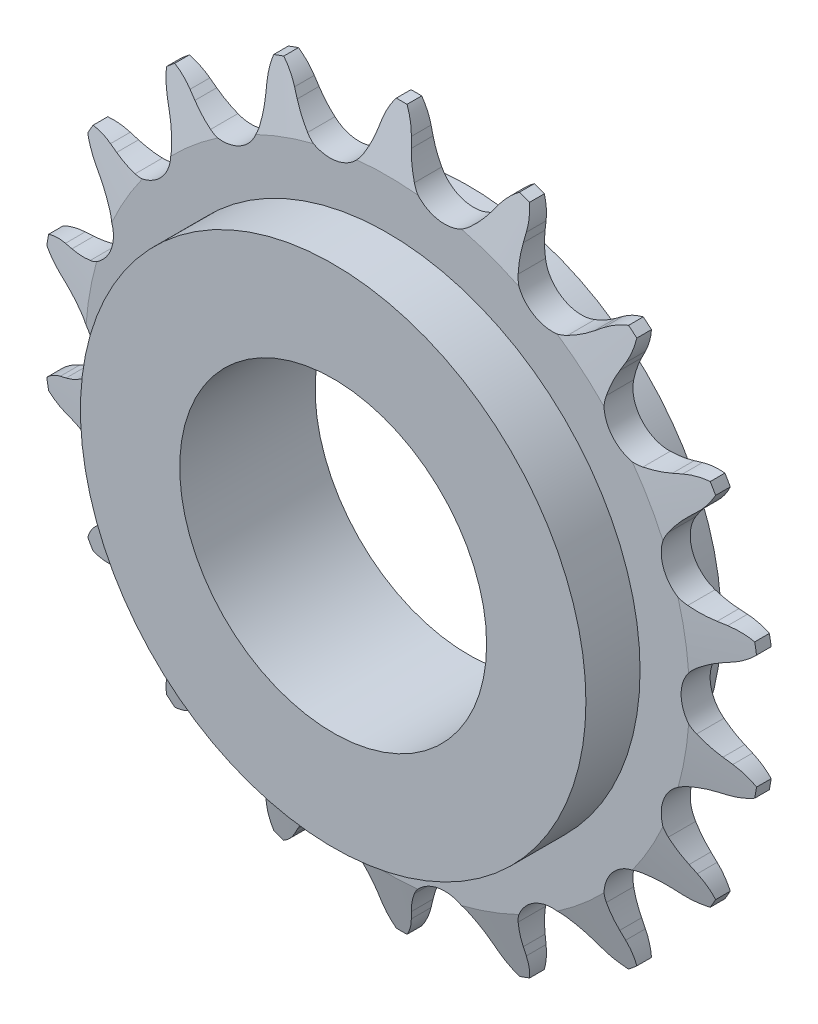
SolidWorks part; units mm, degrees
ref_plane "Front Plane" through (0, 0, 0) normal (0, 0, 1) x (1, 0, 0)
ref_plane "Top Plane" through (0, 0, 0) normal (0, 1, 0) x (1, 0, 0)
ref_plane "Right Plane" through (0, 0, 0) normal (1, 0, 0) x (0, 0, -1)
sketch "Sketch0" plane through (0, 0, 0) normal (0, 0, 1) x (1, 0, 0)
  line L0 (6.35, -36.0126) -> (0, 0) construction
  line L1 (0, 0) -> (18.2841, -31.669) construction
  line L2 (0, 0) -> (-6.35, -36.0126) construction
  line L3 (6.35, -36.0126) -> (18.2841, -31.669) construction
  line L4 (6.35, -36.0126) -> (-6.35, -36.0126) construction
  line L5 (11.3039, -35.8321) -> (10.78, -35.0389)
  line L6 (6.35, -36.0126) -> (0, -37.1323) construction
  line L7 (1.6331, -37.5373) -> (1.8541, -36.6128)
  line L8 (0, -36.0126) -> (0, -39.8226) construction
  line L9 (9.0227, -33.0094) -> (2.1353, -40.7487) construction
  line L10 (0, 0) -> (0, -36.0126) construction
  line L11 (10.78, -35.0389) -> (2.1353, -40.7487) construction
  line L12 (0, -39.8226) -> (0, -40.5391) construction
  line L13 (16.7756, -32.218) -> (11.3039, -35.8321) construction
  circle A0 centre (0, 0) radius 39.8226 construction
  circle A1 centre (0, 0) radius 36.5682 construction
  arc A2 (-5.6013, -42.514) -> (19.8041, -38.0343) centre (0, 0) ccw
  circle A3 centre (0, 0) radius 40.5391 construction
  circle A4 centre (6.35, -36.0126) radius 3.9624 construction
  arc A7 (9.0227, -33.0094) -> (2.8113, -34.1046) centre (6.35, -36.0126) ccw
  circle A8 centre (6.35, -36.0126) radius 4.0203 construction
  arc A9 (11.3039, -35.8321) -> (19.8041, -38.0343) centre (16.7756, -32.218) ccw
  arc A10 (10.78, -35.0389) -> (9.0227, -33.0094) centre (2.1353, -40.7487) ccw
  arc A11 (1.6331, -37.5373) -> (-5.6013, -42.514) centre (-4.7447, -36.0126) cw
  arc A12 (1.8541, -36.6128) -> (2.8113, -34.1046) centre (11.9303, -39.0215) cw
  dimension "D1" = 4.0203
  dimension "Dr" = 7.9248
  dimension "Ds" = 8.0406
  dimension "R" = 4.0203
  dimension "Pitch" = 12.7
  dimension "A" = 38.333
  dimension "360/N" = 20
  dimension "B" = 14.889
  dimension "ab" = 11.0947
  dimension "J" = 3.81
  dimension "ac" = 6.3398
sketch "Sketch1" plane through (0, 0, 0) normal (1, 0, 0) x (0, 0, -1)
  line L0 (3.6068, 0) -> (-3.6068, 0)
  line L1 (-3.6068, 0) -> (-3.6068, 33.4726)
  line L2 (-3.6068, 33.4726) -> (-2.0193, 39.8226)
  line L3 (-2.0193, 39.8226) -> (2.0193, 39.8226)
  line L4 (2.0193, 39.8226) -> (3.6068, 33.4726)
  line L5 (3.6068, 33.4726) -> (3.6068, 0)
  line L7 (0, 39.8226) -> (0, 0) construction
  line L8 (-3.6068, 33.4726) -> (3.6068, 33.4726) construction
  line L9 (0, 39.8226) -> (0, -39.8226) construction
  line L10 (-3.6068, 33.4726) -> (-3.6068, 39.8226) construction
  line L11 (-3.6068, 39.8226) -> (-2.0193, 39.8226) construction
  line L12 (2.0193, 39.8226) -> (3.6068, 39.8226) construction
  line L13 (3.6068, 39.8226) -> (3.6068, 33.4726) construction
  dimension "t" = 7.2136
  dimension "g" = 1.5875
  dimension "h" = 6.35
revolve "Revolve1" add sketch "Sketch1" angle 360 mid plane about L0
extrude "Cut-Extrude1" cut sketch "Sketch0" against normal through all and the other way through all
pattern_circular "CirPattern1" count 18 over 360 about axis through (0, 0, 0) along (0, 0, 1) of "Cut-Extrude1"
sketch "Sketch2" plane through (0, 0, 0) normal (0, 0, 1) x (1, 0, 0)
  circle A0 centre (0, 0) radius 7.9375 construction
  circle A1 centre (0, 0) radius 30.1625
  circle A2 centre (0, 0) radius 39.878 construction
  dimension "Bore" = 15.875
  dimension "Hub Dia." = 60.325
  dimension "OD" = 79.756
sketch "Sketch3" plane through (0, 0, 0) normal (0, 0, 1) x (1, 0, 0)
  circle A0 centre (0, 0) radius 7.9375 construction
  circle A1 centre (0, 0) radius 7.9375
  circle A2 centre (0, 0) radius 39.878 construction
  circle A3 centre (0, 0) radius 39.878
extrude "Cut-Extrude2" cut sketch "Sketch3" along normal through all and the other way through all flip side to cut
sketch "Sketch4" plane through (0, 0, 3.6068) normal (0, 0, 1) x (1, 0, 0)
  circle A0 centre (0, 0) radius 28
extrude "Boss-Extrude1" add sketch "Sketch4" along normal blind 6 and the other way blind 9
sketch "Sketch5" plane through (0, 0, 9.6068) normal (0, 0, 1) x (1, 0, 0)
  circle A0 centre (0, 0) radius 17
extrude "Cut-Extrude3" cut sketch "Sketch5" against normal through all
sketch "Sketch6" plane through (0, 0, -3.6068) normal (0, 0, -1) x (-1, 0, 0)
  circle A0 centre (0, 0) radius 44.1517
  circle A1 centre (0, 0) radius 28
extrude "Cut-Extrude4" cut sketch "Sketch6" against normal blind 4
equation "\"360/N@Sketch0\" = 360/\"Teeth@CirPattern1\""
equation "\"Ds@Sketch0\" = 1.005 * \"Dr@Sketch0\" + 0.003"
equation "\"R@Sketch0\" = 1/2 * \"Ds@Sketch0\""
equation "\"A@Sketch0\" = 35 +  ( 60 / \"Teeth@CirPattern1\" ) "
equation "\"B@Sketch0\" = 18 -  ( 56 / \"Teeth@CirPattern1\" )"
equation "\"ac@Sketch0\" = 0.8 * \"Dr@Sketch0\""
equation "\"ab@Sketch0\" = 1.4 * \"Dr@Sketch0\""
equation "\"J@Sketch0\" = 0.3 * \"Pitch@Sketch0\""
equation "\"h@Sketch1\" = \"Pitch@Sketch0\" / 2"
equation "\"g@Sketch1\" = \"h@Sketch1\" / 4"
